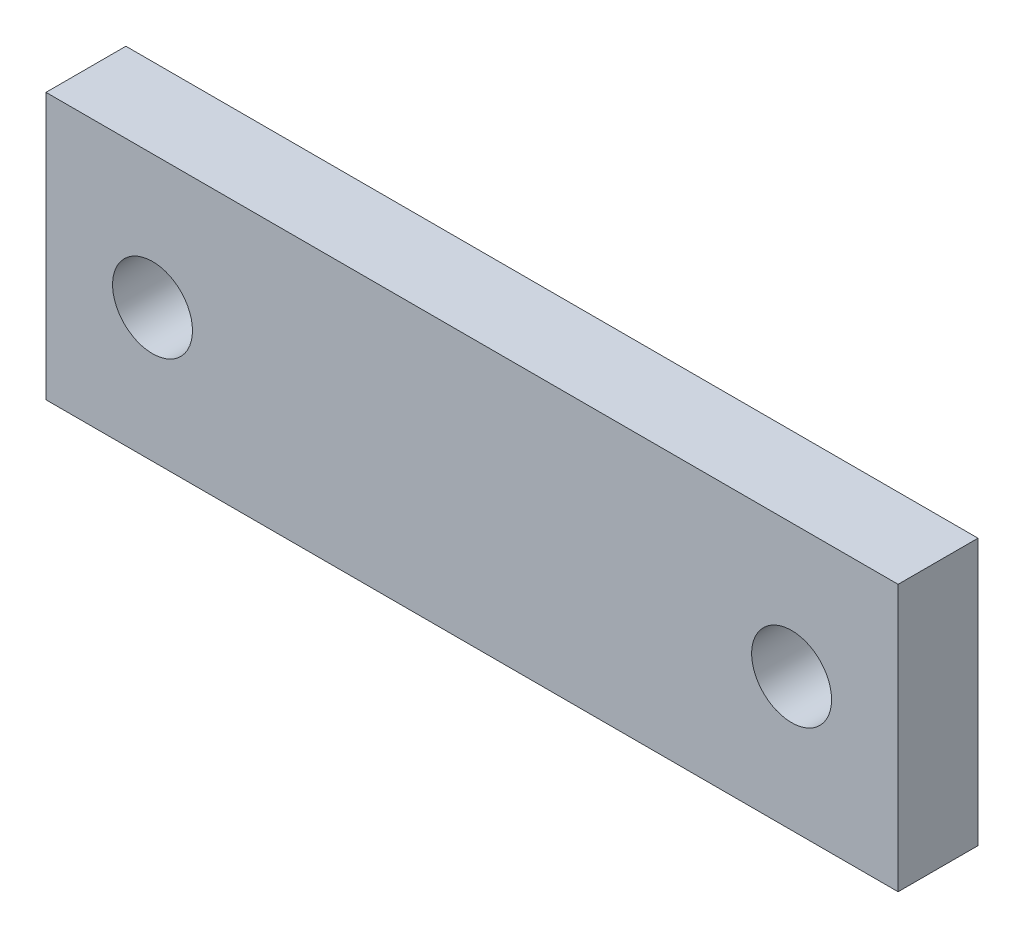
SolidWorks part; units mm, degrees
ref_plane "FRONT" through (0, 0, 0) normal (0, 0, 1) x (1, 0, 0)
ref_plane "TOP" through (0, 0, 0) normal (0, 1, 0) x (1, 0, 0)
ref_plane "RIGHT" through (0, 0, 0) normal (1, 0, 0) x (0, 0, -1)
sketch "Sketch1"
  dimension "D1" = 31.75
  dimension "D2" = 101.6
extrude "Base-Extrude" add sketch "Sketch1" against normal mid plane 9.525
sketch "Sketch2"
  dimension "D1" = 9.525
  dimension "D2" = 12.7
  dimension "D3" = 76.2
  dimension "D4" = 15.875
extrude "Cut-Extrude1" cut sketch "Sketch2" against normal through all
